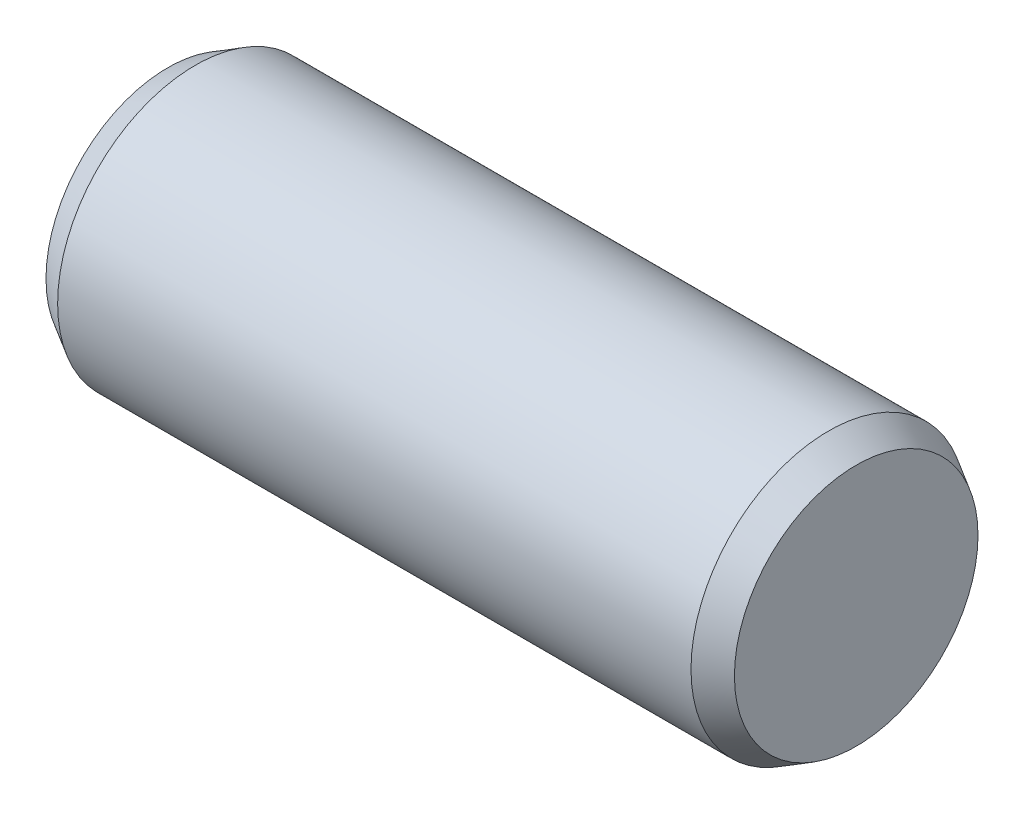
SolidWorks part; units mm, degrees
ref_plane "Front Plane" through (0, 0, 0) normal (0, 0, 1) x (1, 0, 0)
ref_plane "Top Plane" through (0, 0, 0) normal (0, 1, 0) x (1, 0, 0)
ref_plane "Right Plane" through (0, 0, 0) normal (1, 0, 0) x (0, 0, -1)
sketch "BodySke" plane through (0, 0, 0) normal (0, 0, 1) x (1, 0, 0)
  line L0 (0, 0) -> (123.0489, 0) construction
  line L1 (0, 0) -> (0, 17.6906)
  line L2 (0, 17.6906) -> (4, 20)
  line L3 (4, 20) -> (96, 20)
  line L4 (96, 20) -> (100, 17.6906)
  line L5 (100, 17.6906) -> (100, 0)
  line L6 (100, 0) -> (0, 0)
  circle A0 centre (10, 0) radius 4 construction
  circle A1 centre (90, 0) radius 4 construction
  dimension "D1" = 10
  dimension "Hole_dia" = 8
  dimension "Diameter" = 40
  dimension "Length" = 100
  dimension "Chamfer_width" = 4
  dimension "Chamfer_angle" = 30
  dimension "Hole_height" = 10
revolve "BaseBody" add sketch "BodySke" angle 360 about L0
sketch "HoleSke" plane through (0, 0, 0) normal (0, 0, 1) x (1, 0, 0)
  line L0 (0, 0) -> (103.0888, 0) construction
  line L1 (0, 17.6906) -> (0, -17.6906) construction
  circle A0 centre (90, 0) radius 4 construction
  circle A1 centre (10, 0) radius 4 construction
  circle A2 centre (90, 0) radius 4
  circle A3 centre (10, 0) radius 4
extrude "Hole" [suppressed] cut sketch "HoleSke" against normal through all and the other way through all
equation "\"D1@BodySke\" = \"Hole_height@BodySke\""
